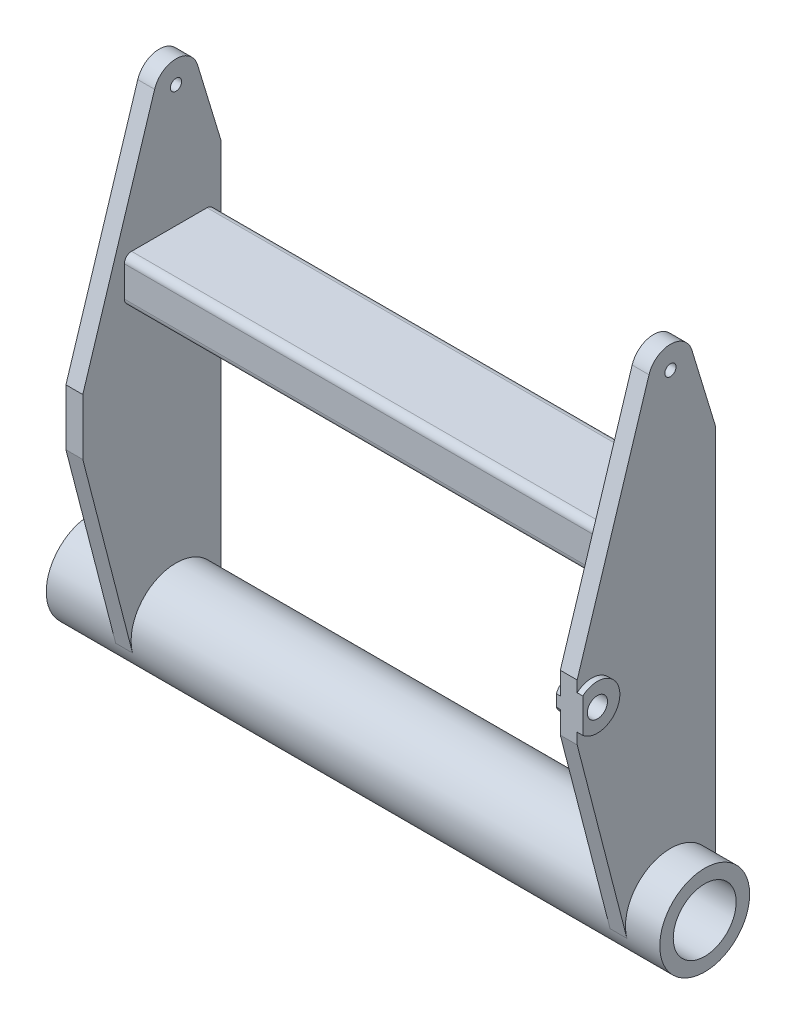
SolidWorks part; units mm, degrees
ref_plane "Face" through (0, 0, 0) normal (0, 0, 1) x (1, 0, 0)
ref_plane "Dessus" through (0, 0, 0) normal (0, 1, 0) x (1, 0, 0)
ref_plane "Droite" through (0, 0, 0) normal (1, 0, 0) x (0, 0, -1)
ref_plane "Plan1" through (212.5, 0, 0) normal (1, 0, 0) x (0, 0, -1)
sketch "Esquisse1" plane through (212.5, 0, 0) normal (1, 0, 0) x (0, 0, -1)
  line L0 (40, 0) -> (40, 345.7434)
  line L1 (40, 345.7434) -> (19.1363, 414.414)
  line L2 (-38.7276, -10.0086) -> (-83, 161.3)
  line L3 (-83, 161.3) -> (-83, 211.3)
  line L4 (-83, 211.3) -> (-19.0792, 414.5988)
  line L5 (0, 0) -> (0, 468.7784) construction
  arc A0 (40, 0) -> (-38.7276, -10.0086) centre (0, 0) ccw
  arc A1 (19.1363, 414.414) -> (-19.0792, 414.5988) centre (0, 408.6) ccw
  circle A2 centre (-70, 186.3) radius 9
  dimension "D1" = 20
  dimension "D4" = 40
  dimension "D7" = 186.3
  dimension "D8" = 408.6
  dimension "D9" = 40
  dimension "D10" = 18
  dimension "D11" = 70
  dimension "D2" = 123
  dimension "D3" = 16.9
  dimension "D5" = 25
  dimension "D6" = 25
extrude "Extrusion1" add sketch "Esquisse1" along normal blind 15
sketch "Esquisse2" plane through (212.5, 0, 0) normal (-1, 0, 0) x (0, 0, 1)
  line L0 (-34, 293.6) -> (-34, 266.4)
  line L1 (-27.6, 296.8) -> (39.6, 296.8)
  line L2 (-30.8, 293.6) -> (-30.8, 266.4)
  line L3 (-27.6, 263.2) -> (39.6, 263.2)
  line L4 (42.8, 293.6) -> (42.8, 266.4)
  line L5 (-27.6, 260) -> (39.6, 260)
  line L6 (46, 293.6) -> (46, 266.4)
  line L7 (-27.6, 300) -> (39.6, 300)
  line L8 (-40, 0) -> (-40, 345.7434) construction
  arc A0 (-30.8, 293.6) -> (-27.6, 296.8) centre (-27.6, 293.6) cw
  arc A1 (-27.6, 263.2) -> (-30.8, 266.4) centre (-27.6, 266.4) cw
  arc A2 (42.8, 266.4) -> (39.6, 263.2) centre (39.6, 266.4) cw
  arc A3 (39.6, 296.8) -> (42.8, 293.6) centre (39.6, 293.6) cw
  arc A4 (-27.6, 260) -> (-34, 266.4) centre (-27.6, 266.4) cw
  arc A5 (46, 266.4) -> (39.6, 260) centre (39.6, 266.4) cw
  arc A6 (39.6, 300) -> (46, 293.6) centre (39.6, 293.6) cw
  arc A7 (-34, 293.6) -> (-27.6, 300) centre (-27.6, 293.6) cw
  arc A8 (38.7276, -10.0086) -> (-40, 0) centre (0, 0) ccw construction
  point P6 (-30.8, 296.8)
  point P11 (42.8, 263.2)
  point P14 (42.8, 296.8)
  dimension "D3" = 3.2
  dimension "D6" = 260
  dimension "D1" = 73.6
  dimension "D2" = 33.6
  dimension "D5" = 6
  dimension "D4" = 3.2
extrude "Extrusion2" add sketch "Esquisse2" along normal blind 425
sketch "Esquisse3" plane through (227.5, 0, 0) normal (1, 0, 0) x (0, 0, -1)
  circle A0 centre (0, 0) radius 40
  circle A1 centre (0, 0) radius 28
  arc A2 (40, 0) -> (-38.7276, -10.0086) centre (0, 0) ccw construction
  dimension "D1" = 56
extrude "Extrusion3" add sketch "Esquisse3" along normal blind 30.5 and the other way blind 515.5
sketch "Esquisse5" plane through (-212.5, 0, 0) normal (-1, 0, 0) x (0, 0, 1)
  line L5 (38.7276, -10.0086) -> (83, 161.3)
  line L6 (83, 161.3) -> (83, 211.3)
  line L7 (83, 211.3) -> (19.0792, 414.5988)
  line L8 (-19.1363, 414.414) -> (-40, 345.7434)
  line L9 (-40, 345.7434) -> (-40, 0)
  line L10 (38.7276, -10.0086) -> (83, 161.3)
  line L11 (83, 161.3) -> (83, 211.3)
  line L12 (83, 211.3) -> (19.0792, 414.5988)
  line L13 (-19.1363, 414.414) -> (-40, 345.7434)
  line L14 (-40, 345.7434) -> (-40, 0)
  arc A2 (38.7276, -10.0086) -> (-40, 0) centre (0, 0) ccw
  arc A3 (19.0792, 414.5988) -> (-19.1363, 414.414) centre (0, 408.6) ccw
  arc A4 (38.7276, -10.0086) -> (-40, 0) centre (0, 0) ccw
  arc A5 (19.0792, 414.5988) -> (-19.1363, 414.414) centre (0, 408.6) ccw
  dimension "D1" = 0
extrude "Extrusion5" add sketch "Esquisse5" along normal blind 15
sketch "Esquisse6" plane through (227.5, 0, 0) normal (1, 0, 0) x (0, 0, -1)
  line L0 (-83, 211.3) -> (-83, 161.3) construction
  line L1 (-83, 201.4987) -> (-83, 171.1013)
  arc A0 (-83, 171.1013) -> (-83, 201.4987) centre (-70, 186.3) ccw
  circle A1 centre (-70, 186.3) radius 9 construction
  circle A2 centre (-70, 186.3) radius 9
  dimension "D1" = 40
extrude "Extrusion7" add sketch "Esquisse6" along normal blind 5
sketch "Esquisse7" plane through (212.5, 0, 0) normal (-1, 0, 0) x (0, 0, 1)
  line L0 (83, 211.3) -> (83, 161.3) construction
  line L1 (83, 191.4962) -> (83, 181.1038)
  arc A0 (83, 191.4962) -> (83, 181.1038) centre (70, 186.3) ccw
  circle A1 centre (70, 186.3) radius 9 construction
  circle A2 centre (70, 186.3) radius 9
  dimension "D1" = 28
extrude "Extrusion8" add sketch "Esquisse7" along normal blind 3.5
sketch "Esquisse8" plane through (227.5, 0, 0) normal (1, 0, 0) x (0, 0, -1)
  circle A0 centre (0, 408.6) radius 5
  dimension "D1" = 10
extrude "Enlèv. mat.-Extru.1" cut sketch "Esquisse8" against normal through all
